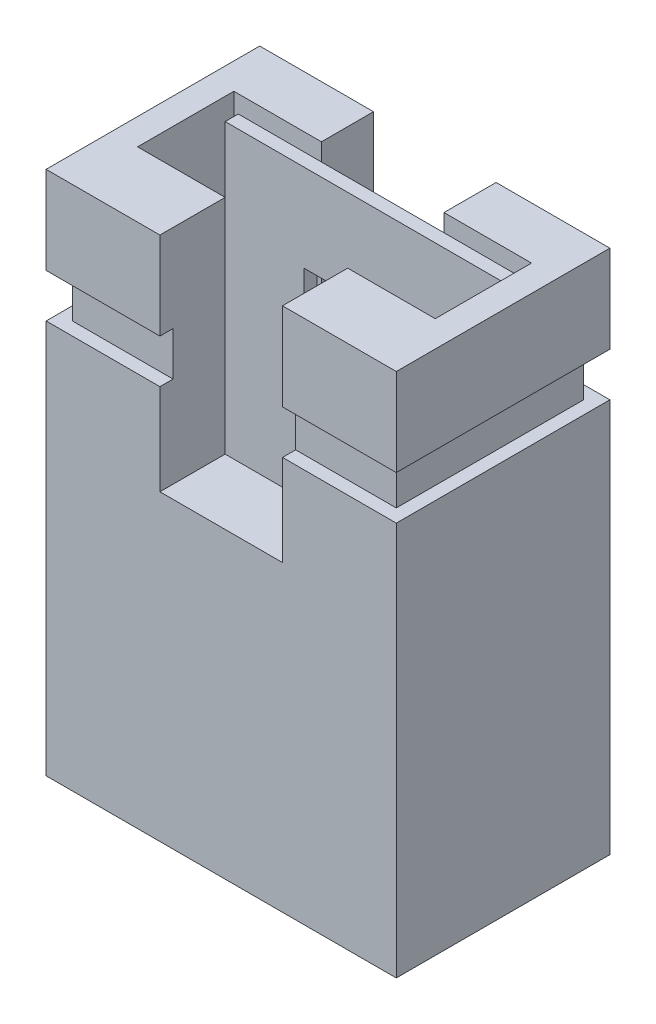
SolidWorks part; units mm, degrees
ref_plane "Front" through (0, 0, 0) normal (0, 0, 1) x (1, 0, 0)
ref_plane "Top" through (0, 0, 0) normal (0, 1, 0) x (1, 0, 0)
ref_plane "Right" through (0, 0, 0) normal (1, 0, 0) x (0, 0, -1)
sketch "Эскиз1" plane through (0, 0, 0) normal (0, 0, 1) x (1, 0, 0)
  line L0 (0, 3.46) -> (0, 0) construction
  line L1 (-2, 0) -> (2, 0)
  line L2 (-2, 0) -> (-2, 4.5)
  line L3 (-2, 6) -> (-0.7, 6)
  line L4 (2, 0) -> (2, 4.5)
  line L5 (-2, 5) -> (-1.85, 5)
  line L6 (2, 5) -> (2, 6)
  line L7 (-2, 4.5) -> (-1.85, 4.5)
  line L8 (-1.85, 5) -> (-1.85, 4.5)
  line L9 (1.85, 5) -> (1.85, 4.5)
  line L10 (2, 4.5) -> (1.85, 4.5)
  line L11 (0.7, 6) -> (2, 6)
  line L12 (2, 5) -> (1.85, 5)
  line L13 (-2, 5) -> (-2, 6)
  line L15 (-0.7, 6) -> (-0.7, 3.46)
  line L16 (-0.7, 3.46) -> (0.7, 3.46)
  line L17 (0.7, 6) -> (0.7, 3.46)
  dimension "D1" = 6
  dimension "D2" = 4
  dimension "D3" = 0.5
  dimension "D4" = 1
  dimension "D5" = 0.15
  dimension "D6" = 1.4
  dimension "D7" = 2.54
extrude "Вытянуть1" add sketch "Эскиз1" along normal mid plane 2.44
sketch "Эскиз2" plane through (1.85, 0, 0) normal (1, 0, 0) x (0, 0, -1)
  line L0 (-1.22, 5) -> (1.22, 5) construction
  line L1 (-1.22, 4.5) -> (-1.07, 4.5)
  line L2 (-1.22, 4.5) -> (-1.22, 5)
  line L3 (-1.22, 5) -> (-1.07, 5)
  line L4 (-1.07, 4.5) -> (-1.07, 5)
  line L5 (-1.22, 5) -> (1.22, 5) construction
  line L6 (1.22, 4.5) -> (1.07, 4.5)
  line L7 (1.22, 4.5) -> (1.22, 5)
  line L8 (1.22, 5) -> (1.07, 5)
  line L9 (1.07, 4.5) -> (1.07, 5)
  dimension "D1" = 0.15
extrude "Вытянуть2" cut sketch "Эскиз2" against normal through all
sketch "Эскиз3" plane through (0, 0, 0) normal (0, 1, 0) x (1, 0, 0)
  line L1 (-1.7, -0.475) -> (1.7, -0.475)
  line L2 (-1.7, -0.475) -> (-1.7, 0.625)
  line L3 (-1.7, 0.625) -> (1.7, 0.625)
  line L4 (1.7, -0.475) -> (1.7, 0.625)
  line L5 (-1.7, -0.475) -> (1.7, 0.625) construction
  line L6 (-1.7, 0.625) -> (1.7, -0.475) construction
  point P0 (0, 0.075)
  dimension "D1" = 3.4
  dimension "D2" = 1.1
  dimension "D3" = 0.075
extrude "Вытянуть3" cut sketch "Эскиз3" along normal through all
sketch "Эскиз4" plane through (0, 0, -0.625) normal (0, 0, 1) x (1, 0, 0)
  line L0 (-1.65, 0.4) -> (-1.65, 5.8)
  line L1 (-1.65, 5.8) -> (1.65, 5.8)
  line L2 (0, 0) -> (0, 5.8) construction
  line L3 (0.75, 4.8) -> (-0.75, 4.8)
  line L4 (-0.75, 4.8) -> (-0.75, 1.9)
  line L5 (-0.75, 1.9) -> (0.75, 1.9)
  line L6 (-1.65, 0.4) -> (1.65, 0.4)
  line L7 (0.75, 4.8) -> (0.75, 1.9)
  line L8 (1.65, 0.4) -> (1.65, 5.8)
  line L9 (-2, 0) -> (2, 0) construction
  line L10 (-0.7, 6) -> (-2, 6) construction
  point P12 (0, 0.4)
  point P13 (0, 1.9)
  point P14 (0, 4.8)
  dimension "D1" = 3.3
  dimension "D2" = 0.4
  dimension "D3" = 0.2
  dimension "D4" = 1
  dimension "D5" = 1.5
  dimension "D6" = 0.9
extrude "Вытянуть4" add sketch "Эскиз4" along normal blind 0.15
